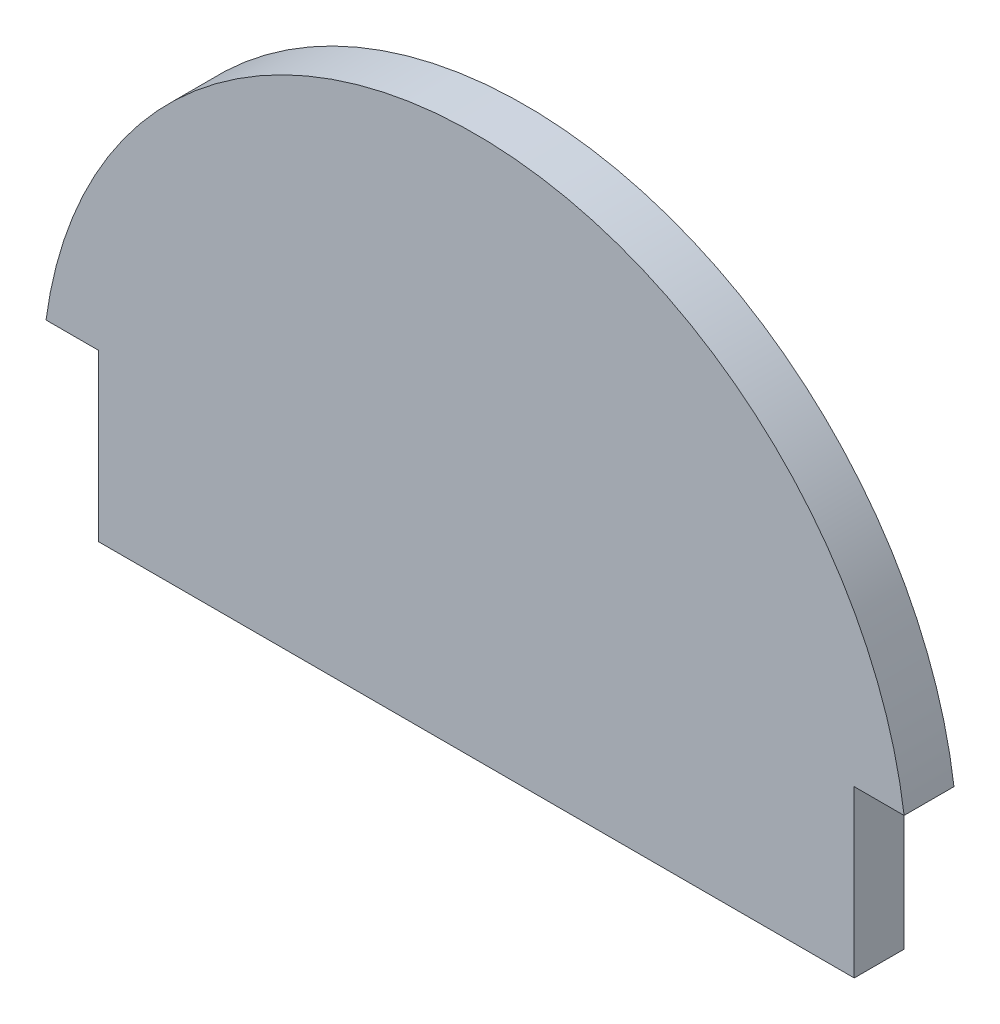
SolidWorks part; units mm, degrees
ref_plane "Front Plane" through (0, 0, 0) normal (0, 0, 1) x (1, 0, 0)
ref_plane "Top Plane" through (0, 0, 0) normal (0, 1, 0) x (1, 0, 0)
ref_plane "Right Plane" through (0, 0, 0) normal (1, 0, 0) x (0, 0, -1)
sketch "Sketch1" plane through (0, 0, 0) normal (0, 0, 1) x (1, 0, 0)
  line L0 (0, 10.1351) -> (1.6059, 10.1351)
  line L1 (24.6936, 10.1351) -> (26.2176, 10.1351)
  line L2 (1.6059, 10.1351) -> (1.6059, 5.0721)
  line L3 (1.6059, 5.0721) -> (24.6936, 5.0721)
  line L5 (24.6936, 10.1351) -> (24.6936, 5.0721)
  line L6 (24.6936, 10.1351) -> (24.6936, -11.7284) construction
  arc A0 (0, 10.1351) -> (26.2176, 10.1351) centre (13.1088, 8.3938) cw
  arc A1 (3.2119, 10.1351) -> (23.0057, 10.1351) centre (13.1088, 8.3938) cw construction
  arc A3 (3.1474, 9.717) -> (23.0702, 9.717) centre (13.1088, 8.3938) cw construction
  dimension "D1" = 3.175
extrude "Boss-Extrude1" add sketch "Sketch1" against normal blind 1.524
